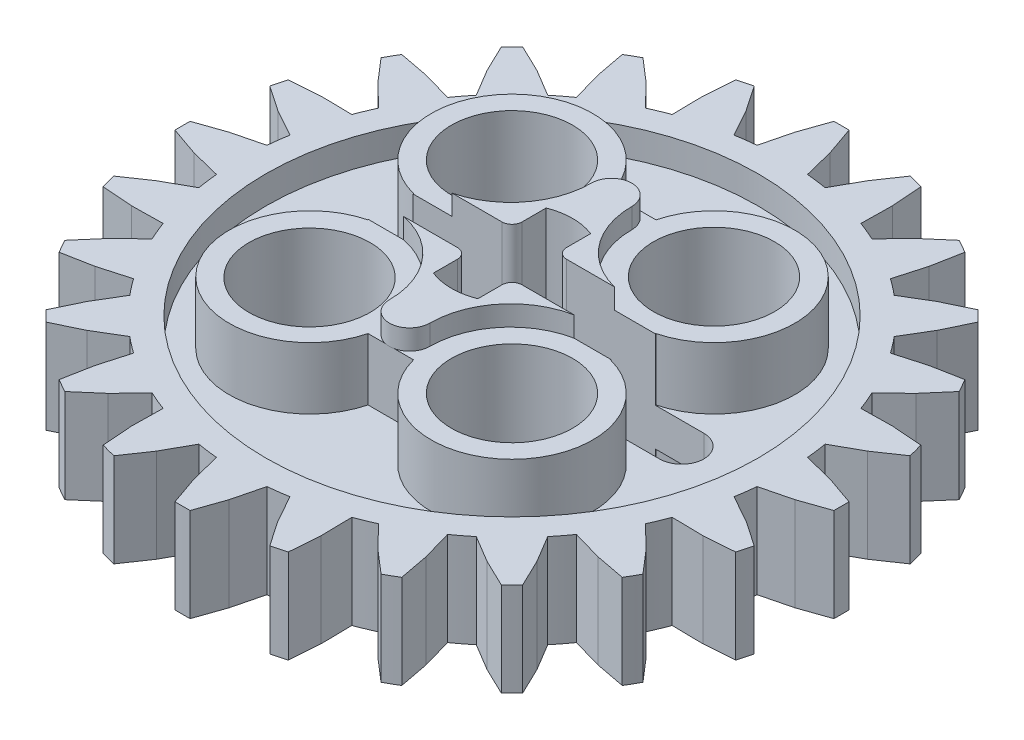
SolidWorks part; units mm, degrees
ref_plane "정면" through (0, 0, 0) normal (0, 0, 1) x (1, 0, 0)
ref_plane "윗면" through (0, 0, 0) normal (0, 1, 0) x (1, 0, 0)
ref_plane "우측면" through (0, 0, 0) normal (1, 0, 0) x (0, 0, -1)
ref_plane "평면1" through (0, -1.855, 0) normal (0, -1, 0) x (1, 0, 0)
sketch "스케치1" plane through (0, -1.855, 0) normal (0, -1, 0) x (1, 0, 0)
  line L0 (6.7831, -11.1486) -> (6.5562, -9.9557)
  line L1 (6.5562, -9.9557) -> (6.2177, -8.7694)
  line L2 (6.8613, -8.2755) -> (7.9196, -8.9095)
  line L3 (7.9196, -8.9095) -> (9.0132, -9.4374)
  line L4 (9.4374, -9.0132) -> (8.9095, -7.9196)
  line L5 (8.9095, -7.9196) -> (8.2755, -6.8613)
  line L6 (8.7694, -6.2177) -> (9.9557, -6.5562)
  line L7 (9.9557, -6.5562) -> (11.1486, -6.7831)
  line L8 (11.4486, -6.2635) -> (10.6557, -5.3438)
  line L9 (10.6557, -5.3438) -> (9.7694, -4.4857)
  line L10 (10.0799, -3.7362) -> (11.3133, -3.7561)
  line L11 (11.3133, -3.7561) -> (12.5244, -3.6665)
  line L12 (12.6796, -3.0869) -> (11.6757, -2.4038)
  line L13 (11.6757, -2.4038) -> (10.5975, -1.8043)
  line L14 (10.7034, -1) -> (11.9, -0.7)
  line L15 (11.9, -0.7) -> (13.0466, -0.3)
  line L16 (13.0466, 0.3) -> (11.9, 0.7)
  line L17 (11.9, 0.7) -> (10.7034, 1)
  line L18 (10.5975, 1.8043) -> (11.6757, 2.4038)
  line L19 (11.6757, 2.4038) -> (12.6796, 3.0869)
  line L20 (12.5244, 3.6665) -> (11.3133, 3.7561)
  line L21 (11.3133, 3.7561) -> (10.0799, 3.7362)
  line L22 (9.7694, 4.4857) -> (10.6557, 5.3438)
  line L23 (10.6557, 5.3438) -> (11.4486, 6.2635)
  line L24 (11.1486, 6.7831) -> (9.9557, 6.5562)
  line L25 (9.9557, 6.5562) -> (8.7694, 6.2177)
  line L26 (8.2755, 6.8613) -> (8.9095, 7.9196)
  line L27 (8.9095, 7.9196) -> (9.4374, 9.0132)
  line L28 (9.0132, 9.4374) -> (7.9196, 8.9095)
  line L29 (7.9196, 8.9095) -> (6.8613, 8.2755)
  line L30 (6.2177, 8.7694) -> (6.5562, 9.9557)
  line L31 (6.5562, 9.9557) -> (6.7831, 11.1486)
  line L32 (6.2635, 11.4486) -> (5.3438, 10.6557)
  line L33 (5.3438, 10.6557) -> (4.4857, 9.7694)
  line L34 (3.7362, 10.0799) -> (3.7561, 11.3133)
  line L35 (3.7561, 11.3133) -> (3.6665, 12.5244)
  line L36 (3.0869, 12.6796) -> (2.4038, 11.6757)
  line L37 (2.4038, 11.6757) -> (1.8043, 10.5975)
  line L38 (1, 10.7034) -> (0.7, 11.9)
  line L39 (0.7, 11.9) -> (0.3, 13.0466)
  line L40 (-0.3, 13.0466) -> (-0.7, 11.9)
  line L41 (-0.7, 11.9) -> (-1, 10.7034)
  line L42 (-1.8043, 10.5975) -> (-2.4038, 11.6757)
  line L43 (-2.4038, 11.6757) -> (-3.0869, 12.6796)
  line L44 (-3.6665, 12.5244) -> (-3.7561, 11.3133)
  line L45 (-3.7561, 11.3133) -> (-3.7362, 10.0799)
  line L46 (-4.4857, 9.7694) -> (-5.3438, 10.6557)
  line L47 (-5.3438, 10.6557) -> (-6.2635, 11.4486)
  line L48 (-6.7831, 11.1486) -> (-6.5562, 9.9557)
  line L49 (-6.5562, 9.9557) -> (-6.2177, 8.7694)
  line L50 (-6.8613, 8.2755) -> (-7.9196, 8.9095)
  line L51 (-7.9196, 8.9095) -> (-9.0132, 9.4374)
  line L52 (-9.4374, 9.0132) -> (-8.9095, 7.9196)
  line L53 (-8.9095, 7.9196) -> (-8.2755, 6.8613)
  line L54 (-8.7694, 6.2177) -> (-9.9557, 6.5562)
  line L55 (-9.9557, 6.5562) -> (-11.1486, 6.7831)
  line L56 (-11.4486, 6.2635) -> (-10.6557, 5.3438)
  line L57 (-10.6557, 5.3438) -> (-9.7694, 4.4857)
  line L58 (-10.0799, 3.7362) -> (-11.3133, 3.7561)
  line L59 (-11.3133, 3.7561) -> (-12.5244, 3.6665)
  line L60 (-12.6796, 3.0869) -> (-11.6757, 2.4038)
  line L61 (-11.6757, 2.4038) -> (-10.5975, 1.8043)
  line L62 (-10.7034, 1) -> (-11.9, 0.7)
  line L63 (-11.9, 0.7) -> (-13.0466, 0.3)
  line L64 (-13.0466, -0.3) -> (-11.9, -0.7)
  line L65 (-11.9, -0.7) -> (-10.7034, -1)
  line L66 (-10.5975, -1.8043) -> (-11.6757, -2.4038)
  line L67 (-11.6757, -2.4038) -> (-12.6796, -3.0869)
  line L68 (-12.5244, -3.6665) -> (-11.3133, -3.7561)
  line L69 (-11.3133, -3.7561) -> (-10.0799, -3.7362)
  line L70 (-9.7694, -4.4857) -> (-10.6557, -5.3438)
  line L71 (-10.6557, -5.3438) -> (-11.4486, -6.2635)
  line L72 (-11.1486, -6.7831) -> (-9.9557, -6.5562)
  line L73 (-9.9557, -6.5562) -> (-8.7694, -6.2177)
  line L74 (-8.2755, -6.8613) -> (-8.9095, -7.9196)
  line L75 (-8.9095, -7.9196) -> (-9.4374, -9.0132)
  line L76 (-9.0132, -9.4374) -> (-7.9196, -8.9095)
  line L77 (-7.9196, -8.9095) -> (-6.8613, -8.2755)
  line L78 (-6.2177, -8.7694) -> (-6.5562, -9.9557)
  line L79 (-6.5562, -9.9557) -> (-6.7831, -11.1486)
  line L80 (-6.2635, -11.4486) -> (-5.3438, -10.6557)
  line L81 (-5.3438, -10.6557) -> (-4.4857, -9.7694)
  line L82 (-3.7362, -10.0799) -> (-3.7561, -11.3133)
  line L83 (-3.7561, -11.3133) -> (-3.6665, -12.5244)
  line L84 (-3.0869, -12.6796) -> (-2.4038, -11.6757)
  line L85 (-2.4038, -11.6757) -> (-1.8043, -10.5975)
  line L86 (-1, -10.7034) -> (-0.7, -11.9)
  line L87 (-0.7, -11.9) -> (-0.3, -13.0466)
  line L88 (0.3, -13.0466) -> (0.7, -11.9)
  line L89 (0.7, -11.9) -> (1, -10.7034)
  line L90 (1.8043, -10.5975) -> (2.4038, -11.6757)
  line L91 (2.4038, -11.6757) -> (3.0869, -12.6796)
  line L92 (3.6665, -12.5244) -> (3.7561, -11.3133)
  line L93 (3.7561, -11.3133) -> (3.7362, -10.0799)
  line L94 (4.4857, -9.7694) -> (5.3438, -10.6557)
  line L95 (5.3438, -10.6557) -> (6.2635, -11.4486)
  line L96 (6.72, -0.88) -> (-6.72, -0.88)
  line L97 (-6.72, 0.88) -> (6.72, 0.88)
  arc A0 (6.2635, -11.4486) -> (6.7831, -11.1486) centre (0, 0) ccw
  arc A1 (6.2177, -8.7694) -> (6.8613, -8.2755) centre (0, 0) ccw
  arc A2 (9.0132, -9.4374) -> (9.4374, -9.0132) centre (0, 0) ccw
  arc A3 (8.2755, -6.8613) -> (8.7694, -6.2177) centre (0, 0) ccw
  arc A4 (11.1486, -6.7831) -> (11.4486, -6.2635) centre (0, 0) ccw
  arc A5 (9.7694, -4.4857) -> (10.0799, -3.7362) centre (0, 0) ccw
  arc A6 (12.5244, -3.6665) -> (12.6796, -3.0869) centre (0, 0) ccw
  arc A7 (10.5975, -1.8043) -> (10.7034, -1) centre (0, 0) ccw
  arc A8 (13.0466, -0.3) -> (13.0466, 0.3) centre (0, 0) ccw
  arc A9 (10.7034, 1) -> (10.5975, 1.8043) centre (0, 0) ccw
  arc A10 (12.6796, 3.0869) -> (12.5244, 3.6665) centre (0, 0) ccw
  arc A11 (10.0799, 3.7362) -> (9.7694, 4.4857) centre (0, 0) ccw
  arc A12 (11.4486, 6.2635) -> (11.1486, 6.7831) centre (0, 0) ccw
  arc A13 (8.7694, 6.2177) -> (8.2755, 6.8613) centre (0, 0) ccw
  arc A14 (9.4374, 9.0132) -> (9.0132, 9.4374) centre (0, 0) ccw
  arc A15 (6.8613, 8.2755) -> (6.2177, 8.7694) centre (0, 0) ccw
  arc A16 (6.7831, 11.1486) -> (6.2635, 11.4486) centre (0, 0) ccw
  arc A17 (4.4857, 9.7694) -> (3.7362, 10.0799) centre (0, 0) ccw
  arc A18 (3.6665, 12.5244) -> (3.0869, 12.6796) centre (0, 0) ccw
  arc A19 (1.8043, 10.5975) -> (1, 10.7034) centre (0, 0) ccw
  arc A20 (0.3, 13.0466) -> (-0.3, 13.0466) centre (0, 0) ccw
  arc A21 (-1, 10.7034) -> (-1.8043, 10.5975) centre (0, 0) ccw
  arc A22 (-3.0869, 12.6796) -> (-3.6665, 12.5244) centre (0, 0) ccw
  arc A23 (-3.7362, 10.0799) -> (-4.4857, 9.7694) centre (0, 0) ccw
  arc A24 (-6.2635, 11.4486) -> (-6.7831, 11.1486) centre (0, 0) ccw
  arc A25 (-6.2177, 8.7694) -> (-6.8613, 8.2755) centre (0, 0) ccw
  arc A26 (-9.0132, 9.4374) -> (-9.4374, 9.0132) centre (0, 0) ccw
  arc A27 (-8.2755, 6.8613) -> (-8.7694, 6.2177) centre (0, 0) ccw
  arc A28 (-11.1486, 6.7831) -> (-11.4486, 6.2635) centre (0, 0) ccw
  arc A29 (-9.7694, 4.4857) -> (-10.0799, 3.7362) centre (0, 0) ccw
  arc A30 (-12.5244, 3.6665) -> (-12.6796, 3.0869) centre (0, 0) ccw
  arc A31 (-10.5975, 1.8043) -> (-10.7034, 1) centre (0, 0) ccw
  arc A32 (-13.0466, 0.3) -> (-13.0466, -0.3) centre (0, 0) ccw
  arc A33 (-10.7034, -1) -> (-10.5975, -1.8043) centre (0, 0) ccw
  arc A34 (-12.6796, -3.0869) -> (-12.5244, -3.6665) centre (0, 0) ccw
  arc A35 (-10.0799, -3.7362) -> (-9.7694, -4.4857) centre (0, 0) ccw
  arc A36 (-11.4486, -6.2635) -> (-11.1486, -6.7831) centre (0, 0) ccw
  arc A37 (-8.7694, -6.2177) -> (-8.2755, -6.8613) centre (0, 0) ccw
  arc A38 (-9.4374, -9.0132) -> (-9.0132, -9.4374) centre (0, 0) ccw
  arc A39 (-6.8613, -8.2755) -> (-6.2177, -8.7694) centre (0, 0) ccw
  arc A40 (-6.7831, -11.1486) -> (-6.2635, -11.4486) centre (0, 0) ccw
  arc A41 (-4.4857, -9.7694) -> (-3.7362, -10.0799) centre (0, 0) ccw
  arc A42 (-3.6665, -12.5244) -> (-3.0869, -12.6796) centre (0, 0) ccw
  arc A43 (-1.8043, -10.5975) -> (-1, -10.7034) centre (0, 0) ccw
  arc A44 (-0.3, -13.0466) -> (0.3, -13.0466) centre (0, 0) ccw
  arc A45 (1, -10.7034) -> (1.8043, -10.5975) centre (0, 0) ccw
  arc A46 (3.0869, -12.6796) -> (3.6665, -12.5244) centre (0, 0) ccw
  arc A47 (3.7362, -10.0799) -> (4.4857, -9.7694) centre (0, 0) ccw
  arc A48 (-6.72, -0.88) -> (-6.72, 0.88) centre (-6.72, 0) cw
  arc A49 (6.72, 0.88) -> (6.72, -0.88) centre (6.72, 0) cw
extrude "보스-돌출1" add sketch "스케치1" against normal blind 3.71
sketch "스케치2" plane through (0, -1.855, 0) normal (0, -1, 0) x (1, 0, 0)
  line L0 (6.72, -0.88) -> (-6.72, -0.88)
  line L1 (-6.72, 0.88) -> (6.72, 0.88)
  arc A0 (-6.72, -0.88) -> (-6.72, 0.88) centre (-6.72, 0) cw
  arc A1 (6.72, 0.88) -> (6.72, -0.88) centre (6.72, 0) cw
  circle A2 centre (0, 0) radius 9.75
extrude "컷-돌출1" cut sketch "스케치2" against normal blind 1.105
sketch "스케치3" plane through (0, -0.75, 0) normal (0, -1, 0) x (1, 0, 0)
  line L0 (4.8, 0.88) -> (-4.8, 0.88)
  line L1 (-4.8, 0.88) -> (-4.8, 0.9016)
  line L2 (-0.9016, 4.8) -> (0.9016, 4.8)
  line L3 (4.8, 0.9016) -> (4.8, 0.88)
  arc A0 (-4.8, 0.9016) -> (-0.9016, 4.8) centre (-4, 4) cw
  arc A1 (0.9016, 4.8) -> (4.8, 0.9016) centre (4, 4) cw
extrude "보스-돌출2" add sketch "스케치3" along normal blind 2.45
sketch "스케치4" plane through (0, 1.855, 0) normal (0, 1, 0) x (-1, 0, 0)
  line L0 (6.72, -0.88) -> (-6.72, -0.88)
  line L1 (-6.72, 0.88) -> (6.72, 0.88)
  arc A0 (-6.72, -0.88) -> (-6.72, 0.88) centre (-6.72, 0) cw
  arc A1 (6.72, 0.88) -> (6.72, -0.88) centre (6.72, 0) cw
  circle A2 centre (0, 0) radius 9.75
extrude "컷-돌출2" cut sketch "스케치4" against normal blind 1.105
sketch "스케치5" plane through (0, 0.75, 0) normal (0, 1, 0) x (-1, 0, 0)
  line L0 (-0.9016, 4.8) -> (0.9016, 4.8)
  line L1 (4.8, 0.9016) -> (4.8, 0.88)
  line L2 (4.8, 0.88) -> (-4.8, 0.88)
  line L3 (-4.8, 0.88) -> (-4.8, 0.9016)
  arc A0 (0.9016, 4.8) -> (4.8, 0.9016) centre (4, 4) cw
  arc A1 (-4.8, 0.9016) -> (-0.9016, 4.8) centre (-4, 4) cw
extrude "보스-돌출3" add sketch "스케치5" along normal blind 2.45
sketch "스케치6" plane through (0, -3.2, 0) normal (0, -1, 0) x (1, 0, 0)
  line L0 (3.3387, 0.88) -> (-3.4128, 0.88)
  arc A0 (-3.4128, 0.88) -> (-0.8371, 4.0185) centre (-4.0371, 4.0185) ccw
  arc A1 (-0.8371, 4.0185) -> (0.7629, 4.0185) centre (-0.0371, 4.0185) cw
  arc A2 (0.7629, 4.0185) -> (3.3387, 0.88) centre (3.9629, 4.0185) ccw
extrude "보스-돌출4" add sketch "스케치6" along normal blind 0.8
sketch "스케치7" plane through (0, 3.2, 0) normal (0, 1, 0) x (-1, 0, 0)
  line L0 (3.4128, 0.88) -> (-3.3387, 0.88)
  arc A0 (-3.3387, 0.88) -> (-0.7629, 4.0185) centre (-3.9629, 4.0185) ccw
  arc A1 (-0.7629, 4.0185) -> (0.8371, 4.0185) centre (0.0371, 4.0185) cw
  arc A2 (0.8371, 4.0185) -> (3.4128, 0.88) centre (4.0371, 4.0185) ccw
extrude "보스-돌출5" add sketch "스케치7" along normal blind 0.8
sketch "스케치8" plane through (0, -0.75, 0) normal (0, -1, 0) x (1, 0, 0)
  line L0 (-4.8, -0.88) -> (4.8, -0.88)
  line L1 (4.8, -0.88) -> (4.8, -0.9016)
  line L2 (0.9016, -4.8) -> (-0.9016, -4.8)
  line L3 (-4.8, -0.9016) -> (-4.8, -0.88)
  arc A0 (4.8, -0.9016) -> (0.9016, -4.8) centre (4, -4) cw
  arc A1 (-0.9016, -4.8) -> (-4.8, -0.9016) centre (-4, -4) cw
extrude "보스-돌출6" add sketch "스케치8" along normal blind 2.45
sketch "스케치9" plane through (0, 0.75, 0) normal (0, 1, 0) x (-1, 0, 0)
  line L0 (-4.8, -0.88) -> (4.8, -0.88)
  line L1 (4.8, -0.88) -> (4.8, -0.9016)
  line L2 (0.9016, -4.8) -> (-0.9016, -4.8)
  line L3 (-4.8, -0.9016) -> (-4.8, -0.88)
  arc A0 (4.8, -0.9016) -> (0.9016, -4.8) centre (4, -4) cw
  arc A1 (-0.9016, -4.8) -> (-4.8, -0.9016) centre (-4, -4) cw
extrude "보스-돌출7" add sketch "스케치9" along normal blind 2.45
sketch "스케치10" plane through (0, 3.2, 0) normal (0, 1, 0) x (-1, 0, 0)
  line L0 (-3.175, -0.88) -> (3.2491, -0.88)
  arc A0 (3.2491, -0.88) -> (0.8371, -3.9815) centre (4.0371, -3.9815) ccw
  arc A1 (0.8371, -3.9815) -> (-0.7629, -3.9815) centre (0.0371, -3.9815) cw
  arc A2 (-0.7629, -3.9815) -> (-3.175, -0.88) centre (-3.9629, -3.9815) ccw
extrude "보스-돌출8" add sketch "스케치10" along normal blind 0.8
sketch "스케치11" plane through (0, -3.2, 0) normal (0, -1, 0) x (1, 0, 0)
  line L0 (-3.2491, -0.88) -> (3.175, -0.88)
  arc A0 (3.175, -0.88) -> (0.7629, -3.9815) centre (3.9629, -3.9815) ccw
  arc A1 (0.7629, -3.9815) -> (-0.8371, -3.9815) centre (-0.0371, -3.9815) cw
  arc A2 (-0.8371, -3.9815) -> (-3.2491, -0.88) centre (-4.0371, -3.9815) ccw
extrude "보스-돌출9" add sketch "스케치11" along normal blind 0.8
sketch "스케치12" plane through (0, 4, 0) normal (0, 1, 0) x (-1, 0, 0)
  line L0 (-0.88, 0.88) -> (0.88, 0.88)
  line L1 (0.88, 0.88) -> (0.88, 2.2328)
  line L2 (-0.88, 2.2328) -> (-0.88, 0.88)
  arc A0 (0.88, 2.2328) -> (-0.88, 2.2328) centre (0, 0) ccw
extrude "컷-돌출3" cut sketch "스케치12" against normal through all
sketch "스케치13" plane through (0, -4, 0) normal (0, -1, 0) x (1, 0, 0)
  line L0 (0.88, -0.88) -> (-0.88, -0.88)
  line L1 (-0.88, -0.88) -> (-0.88, -2.2328)
  line L2 (0.88, -2.2328) -> (0.88, -0.88)
  arc A0 (-0.88, -2.2328) -> (0.88, -2.2328) centre (0, 0) ccw
extrude "컷-돌출4" cut sketch "스케치13" against normal through all
hole_wizard "#8 여유 구멍1" positions "스케치15" profile "스케치14" hole size "#8" standard "Ansi Inch"
sketch "스케치15" plane through (0, -3.2, 0) normal (0, -1, 0) x (-1, 0, 0)
  point P0 (-4, -4)
  point P1 (3.9815, -4.0371)
  point P2 (-4, 4)
  point P3 (4, 4)
sketch "스케치14" plane through (4, -3.2, 4) normal (1, 0, 0) x (0, 0, -1)
  line L0 (0, 0) -> (0, 7.2)
  line L1 (0, 7.2) -> (2.4, 7.2)
  line L2 (2.4, 7.2) -> (2.4, 0)
  line L5 (2.4, 0) -> (0, 0)
  line L11 (0, -6.35) -> (0, 107.95) construction
  dimension "관통 구멍 지름" = 4.8
  dimension "관통 구멍 깊이" = 7.2
fillet "필렛1" radius 0.4 4 edges at (0.88, 0, 0.88) (-0.88, 0, 0.88) (0.88, 0, -0.88) (-0.88, 0, -0.88)
